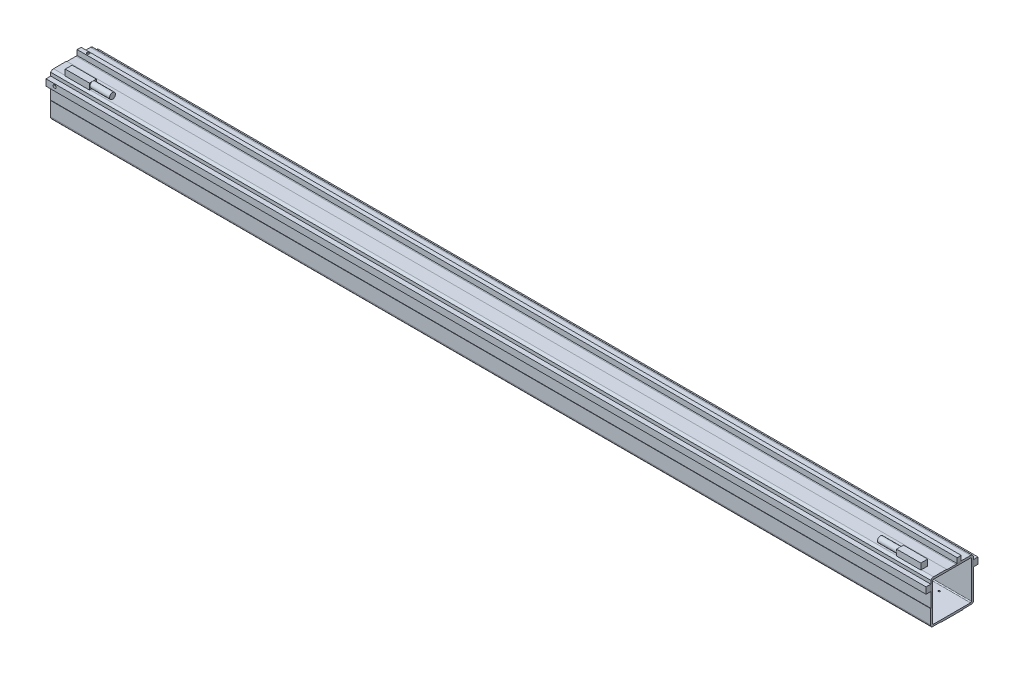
SolidWorks part; units mm, degrees
ref_plane "Ebene vorne" through (0, 0, 0) normal (0, 0, 1) x (1, 0, 0)
ref_plane "Ebene oben" through (0, 0, 0) normal (0, 1, 0) x (1, 0, 0)
ref_plane "Ebene rechts" through (0, 0, 0) normal (1, 0, 0) x (0, 0, -1)
sketch "Skizze1" plane through (0, 0, 0) normal (1, 0, 0) x (0, 0, -1)
  line L0 (-125, 107) -> (-125, -107)
  line L1 (-107, -125) -> (107, -125)
  line L2 (125, -107) -> (125, 107)
  line L3 (107, 125) -> (-107, 125)
  line L4 (-107, 112.5) -> (107, 112.5)
  line L5 (112.5, 107) -> (112.5, -107)
  line L6 (107, -112.5) -> (-107, -112.5)
  line L7 (-112.5, -107) -> (-112.5, 107)
  line L8 (-107, 107) -> (107, -107) construction
  arc A0 (-125, -107) -> (-107, -125) centre (-107, -107) ccw
  arc A1 (107, -125) -> (125, -107) centre (107, -107) ccw
  arc A2 (125, 107) -> (107, 125) centre (107, 107) ccw
  arc A3 (-107, 125) -> (-125, 107) centre (-107, 107) ccw
  arc A4 (107, 112.5) -> (112.5, 107) centre (107, 107) cw
  arc A5 (112.5, -107) -> (107, -112.5) centre (107, -107) cw
  arc A6 (-107, -112.5) -> (-112.5, -107) centre (-107, -107) cw
  arc A7 (-112.5, 107) -> (-107, 112.5) centre (-107, 107) cw
  dimension "D3" = 18
  dimension "D1" = 250
  dimension "D2" = 12.5
extrude "Aufsatz-Linear austragen1" add sketch "Skizze1" along normal blind 5100
sketch "Skizze2" plane through (0, 0, 0) normal (1, 0, 0) x (0, 0, -1)
  line L0 (53.37, 125) -> (53.37, 122.5)
  line L1 (107, 125) -> (-107, 125) construction
  line L2 (23.37, 122.5) -> (-31.63, 122.5)
  line L3 (-31.63, 122.5) -> (-31.63, 125)
  line L4 (-31.63, 125) -> (53.37, 125)
  line L5 (123, 125) -> (123, 96)
  line L6 (123, 96) -> (121.5, 96)
  line L7 (121.5, 96) -> (121.5, 59)
  line L8 (121.5, 59) -> (123, 59)
  line L9 (123, 59) -> (123, -25)
  line L10 (123, -25) -> (125, -25)
  line L11 (125, -107) -> (125, 107) construction
  line L12 (125, -25) -> (125, 125)
  line L13 (125, 125) -> (123, 125)
  line L14 (0, 87.8564) -> (0, -44.1244) construction
  line L15 (-125, 125) -> (-123, 125)
  line L16 (-125, -25) -> (-125, 125)
  line L17 (-123, -25) -> (-125, -25)
  line L18 (-123, 59) -> (-123, -25)
  line L19 (-121.5, 59) -> (-123, 59)
  line L20 (-121.5, 96) -> (-121.5, 59)
  line L21 (-123, 96) -> (-121.5, 96)
  line L22 (-123, 125) -> (-123, 96)
  line L23 (-125, 107) -> (-125, -107) construction
  line L24 (-125, -122.5) -> (-62.5, -122.5)
  line L25 (-125, -122.5) -> (-125, -125)
  line L26 (-125, -125) -> (-62.5, -125)
  line L27 (-62.5, -122.5) -> (-62.5, -125)
  line L28 (-107, -125) -> (107, -125) construction
  line L30 (125, -122.5) -> (62.5, -122.5)
  line L31 (125, -122.5) -> (125, -125)
  line L32 (125, -125) -> (62.5, -125)
  line L33 (62.5, -122.5) -> (62.5, -125)
  line L35 (53.37, 122.5) -> (53.37, 122.4)
  line L36 (53.37, 122.4) -> (23.37, 122.4)
  line L37 (23.37, 122.5) -> (23.37, 122.4)
  dimension "D1" = 2.5
  dimension "D2" = 1.5
  dimension "D3" = 59
  dimension "D4" = 2
  dimension "D5" = 37
  dimension "D6" = 53.37
  dimension "D7" = 85
  dimension "D8" = 125
  dimension "D9" = 2.5
  dimension "D10" = 84
  dimension "D11" = 0.1
  dimension "D12" = 30
extrude "Schnitt-Linear austragen2" cut sketch "Skizze2" along normal through all
sketch "Skizze3" plane through (0, 0, 0) normal (1, 0, 0) x (0, 0, -1)
  line L1 (-121.5, 96) -> (-150.5, 96)
  line L2 (-121.5, 96) -> (-121.5, 59)
  line L3 (-121.5, 59) -> (-150.5, 59)
  line L4 (-150.5, 96) -> (-150.5, 59)
  line L5 (121.5, 96) -> (150.5, 96)
  line L6 (121.5, 96) -> (121.5, 59)
  line L7 (121.5, 59) -> (150.5, 59)
  line L8 (150.5, 96) -> (150.5, 59)
  line L9 (53.37, 122.4) -> (30.12, 122.4)
  line L10 (53.37, 122.4) -> (53.37, 152.4)
  line L11 (53.37, 152.4) -> (30.12, 152.4)
  line L12 (30.12, 122.4) -> (30.12, 152.4)
  dimension "D1" = 29
  dimension "D2" = 30
  dimension "D3" = 23.25
extrude "Aufsatz-Linear austragen2" add sketch "Skizze3" along normal up to surface (5100 mm away) separate body
sketch "Skizze4" plane through (0, 125, 0) normal (0, 1, 0) x (1, 0, 0)
  line L0 (5029, -90) -> (5100, -90) construction
  line L1 (71, -70) -> (211, -70)
  line L2 (71, -70) -> (71, -110)
  line L3 (71, -110) -> (211, -110)
  line L4 (211, -70) -> (211, -110)
  line L5 (5029, -70) -> (4889, -70)
  line L6 (5029, -70) -> (5029, -110)
  line L7 (5029, -110) -> (4889, -110)
  line L8 (4889, -70) -> (4889, -110)
  line L9 (5100, -31.63) -> (5100, -107) construction
  line L10 (71, -90) -> (0, -90) construction
  line L11 (0, -31.63) -> (0, -107) construction
  line L12 (5100, -150.5) -> (0, -150.5) construction
  dimension "D1" = 140
  dimension "D2" = 40
  dimension "D3" = 40.5
  dimension "D4" = 71
extrude "Aufsatz-Linear austragen3" add sketch "Skizze4" along normal blind 35
sketch "Skizze5" plane through (4889, 0, 0) normal (-1, 0, 0) x (0, 0, 1)
  line L0 (70, 160) -> (110, 160) construction
  line L1 (90, 142.5) -> (90, 160) construction
  circle A0 centre (90, 142.5) radius 17.25
  dimension "D1" = 17.5
  dimension "D2" = 34.5
extrude "Aufsatz-Linear austragen4" add sketch "Skizze5" along normal blind 114
sketch "Skizze6" plane through (211, 0, 0) normal (1, 0, 0) x (0, 0, -1)
  circle A0 centre (-90, 142.5) radius 17.25 construction
  circle A1 centre (-90, 142.5) radius 17.25
extrude "Aufsatz-Linear austragen5" add sketch "Skizze6" along normal blind 114
hole_wizard "Stirnsenkung für M10 Zylinderschraube mit Innensechskant1" positions "Skizze8" profile "Skizze7" counterbore size "M10" standard "DIN"
sketch "Skizze8" plane through (0, 0, 150.5) normal (0, 0, 1) x (1, 0, 0)
  line L0 (5100, 96) -> (0, 96) construction
  line L1 (0, 96) -> (0, 59) construction
  point P0 (50, 83)
  dimension "D1" = 13
  dimension "D2" = 50
sketch "Skizze7" plane through (50, 83, 150.5) normal (1, 0, 0) x (0, -1, 0)
  line L0 (0, 0) -> (0, 301)
  line L1 (0, 301) -> (5.5, 301)
  line L3 (5.5, 301) -> (5.5, 10.6)
  line L4 (5.5, 10.6) -> (9, 10.6)
  line L5 (9, 10.6) -> (9, 0)
  line L7 (9, 0) -> (0, 0)
  line L11 (0, -6.35) -> (0, 107.95) construction
  dimension "Bohrerdurchmesser" = 11
  dimension "Bohrungstiefe" = 301
  dimension "Senkdurchmesser2" = 18
  dimension "Senktiefe2" = 10.6
hole_wizard "Stirnsenkung für M10 Zylinderschraube mit Innensechskant2" positions "Skizze10" profile "Skizze9" counterbore size "M10" standard "DIN"
sketch "Skizze10" plane through (0, 0, -150.5) normal (0, 0, -1) x (-1, 0, 0)
  circle A0 centre (-50, 83) radius 5.5 construction
  point P0 (-50, 83)
sketch "Skizze9" plane through (50, 83, -150.5) normal (1, 0, 0) x (0, 1, 0)
  line L0 (0, 0) -> (0, 301)
  line L1 (0, 301) -> (5.5, 301)
  line L3 (5.5, 301) -> (5.5, 10.6)
  line L4 (5.5, 10.6) -> (9, 10.6)
  line L5 (9, 10.6) -> (9, 0)
  line L7 (9, 0) -> (0, 0)
  line L11 (0, -6.35) -> (0, 107.95) construction
  dimension "Bohrerdurchmesser" = 11
  dimension "Bohrungstiefe" = 301
  dimension "Senkdurchmesser2" = 18
  dimension "Senktiefe2" = 10.6
hole_wizard "Ø9.3 (9.3) Durchmesser Bohrung1" positions "Skizze12" profile "Skizze11" hole size "Ø9.3" standard "DIN"
sketch "Skizze12" plane through (0, 0, 121.5) normal (0, 0, 1) x (1, 0, 0)
  circle A0 centre (50, 83) radius 5.5 construction
  point P0 (50, 83)
sketch "Skizze11" plane through (50, 83, 121.5) normal (1, 0, 0) x (0, -1, 0)
  line L0 (0, 0) -> (0, 9.001)
  line L1 (0, 9.001) -> (4.65, 9.001)
  line L2 (4.65, 9.001) -> (4.65, 1.1)
  line L3 (4.65, 1.1) -> (5.75, 0)
  line L5 (5.75, 0) -> (0, 0)
  line L6 (-4.65, 1.1) -> (-5.75, 0) construction
  line L11 (0, -6.35) -> (0, 107.95) construction
  dimension "Bohrerdurchmesser" = 9.3
  dimension "Bohrungstiefe" = 9.001
  dimension "Senkdurchmesser2 (Oben)" = 11.5
  dimension "Senkwinkel2 (Oben)" = 90
hole_wizard "Ø9.3 (9.3) Durchmesser Bohrung2" positions "Skizze14" profile "Skizze13" hole size "Ø9.3" standard "DIN"
sketch "Skizze14" plane through (0, 0, -121.5) normal (0, 0, -1) x (-1, 0, 0)
  point P0 (-50, 83)
sketch "Skizze13" plane through (50, 83, -121.5) normal (1, 0, 0) x (0, 1, 0)
  line L0 (0, 0) -> (0, 17.794)
  line L1 (0, 17.794) -> (4.65, 15)
  line L2 (4.65, 15) -> (4.65, 1.1)
  line L3 (4.65, 1.1) -> (5.75, 0)
  line L5 (5.75, 0) -> (0, 0)
  line L6 (-4.65, 1.1) -> (-5.75, 0) construction
  line L10 (0, 17.794) -> (-4.65, 15) construction
  line L11 (0, -6.35) -> (0, 107.95) construction
  dimension "Bohrerdurchmesser" = 9.3
  dimension "Bohrungstiefe" = 15
  dimension "Senkdurchmesser2 (Oben)" = 11.5
  dimension "Senkwinkel2 (Oben)" = 90
  dimension "Spitzenwinkel" = 118
hole_wizard "Stirnsenkung für M8 Zylinderschraube mit Innensechskant1" positions "Skizze16" profile "Skizze15" counterbore size "M8" standard "DIN"
sketch "Skizze16" plane through (0, 152.4, 0) normal (0, 1, 0) x (-1, 0, 0)
  line L0 (-5100, -53.37) -> (0, -53.37) construction
  line L2 (0, -53.37) -> (0, -30.12) construction
  point P0 (-50, -43.37)
  dimension "D1" = 10
  dimension "D2" = 50
sketch "Skizze15" plane through (50, 152.4, -43.37) normal (1, 0, 0) x (0, 0, 1)
  line L0 (0, 0) -> (0, 277.4)
  line L1 (0, 277.4) -> (4.5, 277.4)
  line L3 (4.5, 277.4) -> (4.5, 8.6)
  line L4 (4.5, 8.6) -> (7.5, 8.6)
  line L5 (7.5, 8.6) -> (7.5, 0)
  line L7 (7.5, 0) -> (0, 0)
  line L11 (0, -6.35) -> (0, 107.95) construction
  dimension "Bohrerdurchmesser" = 9
  dimension "Bohrungstiefe" = 277.4
  dimension "Senkdurchmesser2" = 15
  dimension "Senktiefe2" = 8.6
hole_wizard "Ø7.4 (7.4) Durchmesser Bohrung1" positions "Skizze21" profile "Skizze20" hole size "Ø7.4" standard "DIN"
sketch "Skizze21" plane through (0, 122.5, 0) normal (0, 1, 0) x (-1, 0, 0)
  circle A0 centre (-50, -43.37) radius 4.5 construction
  point P0 (-50, -43.37)
sketch "Skizze20" plane through (50, 122.5, -43.37) normal (1, 0, 0) x (0, 0, 1)
  line L0 (0, 0) -> (0, 17.2232)
  line L1 (0, 17.2232) -> (3.7, 15)
  line L2 (3.7, 15) -> (3.7, 0.8)
  line L3 (3.7, 0.8) -> (4.5, 0)
  line L5 (4.5, 0) -> (0, 0)
  line L6 (-3.7, 0.8) -> (-4.5, 0) construction
  line L10 (0, 17.2232) -> (-3.7, 15) construction
  line L11 (0, -6.35) -> (0, 107.95) construction
  dimension "Bohrerdurchmesser" = 7.4
  dimension "Bohrungstiefe" = 15
  dimension "Senkdurchmesser2 (Oben)" = 9
  dimension "Senkwinkel2 (Oben)" = 90
  dimension "Spitzenwinkel" = 118
hole_wizard "M12 Gewindebohrung1" positions "Skizze18" profile "Skizze19" tap size "M12" standard "DIN"
sketch "Skizze18" plane through (0, -122.5, 0) normal (0, -1, 0) x (1, 0, 0)
  line L0 (50, 75) -> (50, -75) construction
  line L2 (50, 0) -> (0, 0) construction
  line L4 (0, 62.5) -> (0, -62.5) construction
  point P0 (50, -75)
  point P1 (50, 75)
  dimension "D1" = 50
  dimension "D2" = 150
sketch "Skizze19" plane through (50, -122.5, -75) normal (1, 0, 0) x (0, 0, -1)
  line L0 (0, 0) -> (0, 247.5)
  line L1 (0, 247.5) -> (5.1, 247.5)
  line L2 (5.1, 247.5) -> (5.1, 0)
  line L5 (5.1, 0) -> (0, 0)
  line L11 (0, -6.35) -> (0, 107.95) construction
  dimension "Bohrerdurchmesser" = 10.2
  dimension "Bohrungstiefe" = 247.5
pattern_linear "Lineares Muster1" count 50 spacing 100
